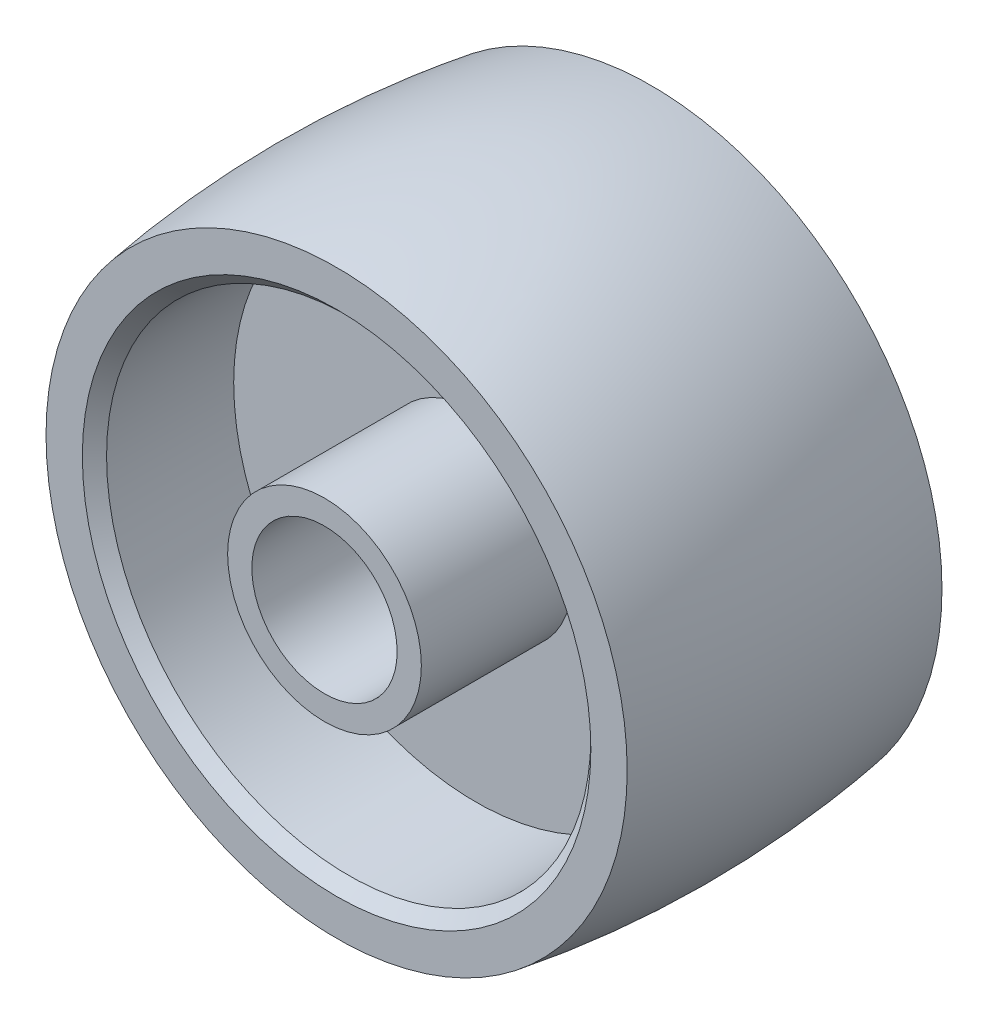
SolidWorks part; units mm, degrees
ref_plane "Plan de face" through (0, 0, 0) normal (0, 0, 1) x (1, 0, 0)
ref_plane "Plan de dessus" through (0, 0, 0) normal (0, 1, 0) x (1, 0, 0)
ref_plane "Plan de droite" through (0, 0, 0) normal (1, 0, 0) x (0, 0, -1)
sketch "Esquisse1" plane through (0, 0, 0) normal (1, 0, 0) x (0, 0, -1)
  line L0 (-4.7147, 0) -> (4.792, 0) construction
  line L1 (7, 3) -> (-7, 3)
  line L2 (-7, 3) -> (-7, 4)
  line L3 (-7, 4) -> (-0.75, 4)
  line L4 (-0.75, 4) -> (-0.75, 10)
  line L5 (-0.75, 10) -> (-6, 10)
  line L6 (-6.5, 10.5) -> (-6.5, 12)
  line L7 (0, -13.8929) -> (0, 13.236) construction
  line L8 (6.5, 10.5) -> (6.5, 12)
  line L9 (0.75, 10) -> (6, 10)
  line L10 (0.75, 4) -> (0.75, 10)
  line L11 (7, 4) -> (0.75, 4)
  line L12 (7, 3) -> (7, 4)
  line L13 (-6, 10) -> (-6.5, 10.5)
  line L14 (6, 10) -> (6.5, 10.5)
  arc A0 (6.5, 12) -> (-6.5, 12) centre (0, -30) ccw
  point P9 (-6.5, 10)
  point P14 (-0.75, 7)
  point P16 (6.5, 10)
  point P22 (0, 3)
  point P26 (0, 12.5)
  dimension "D8" = 12.5
  dimension "D1" = 3
  dimension "D2" = 4
  dimension "D3" = 10
  dimension "D4" = 2
  dimension "D5" = 6.5
  dimension "D6" = 7
  dimension "D7" = 1.5
revolve "Révolution1" add sketch "Esquisse1" angle 360 about L0
